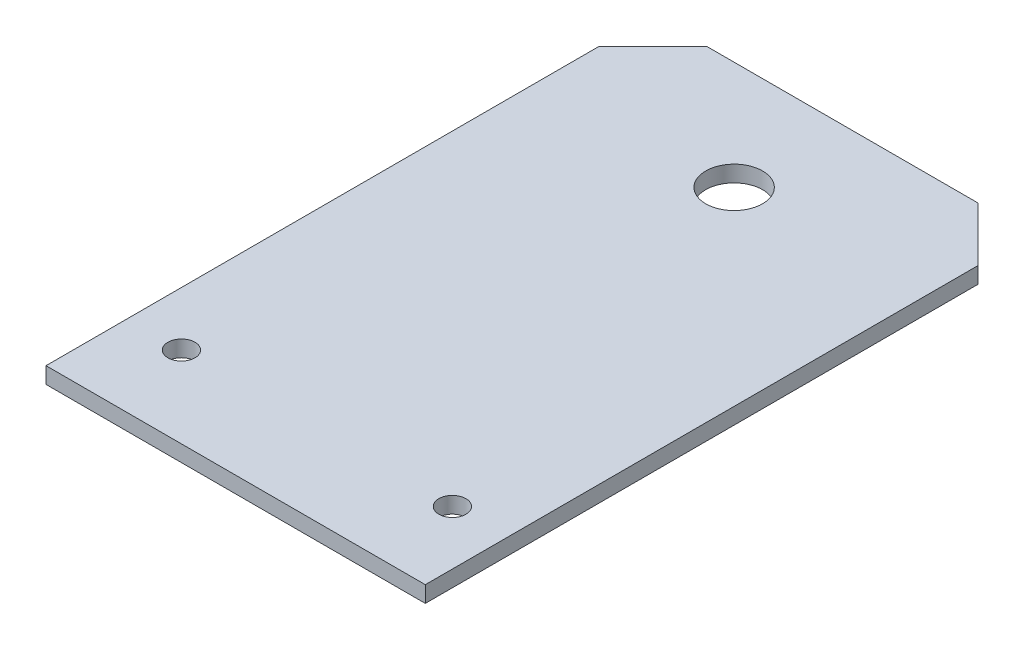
SolidWorks part; units mm, degrees
ref_plane "Front Plane" through (0, 0, 0) normal (0, 0, 1) x (1, 0, 0)
ref_plane "Top Plane" through (0, 0, 0) normal (0, 1, 0) x (1, 0, 0)
ref_plane "Right Plane" through (0, 0, 0) normal (1, 0, 0) x (0, 0, -1)
sketch "Sketch1" plane through (0, 0, 0) normal (0, 1, 0) x (1, 0, 0)
  line L0 (35, 112) -> (35, 0) construction
  line L1 (0, 0) -> (70, 0)
  line L2 (0, 0) -> (0, 102)
  line L3 (10, 112) -> (60, 112)
  line L4 (70, 0) -> (70, 102)
  line L5 (0, 102) -> (10, 112)
  line L6 (60, 112) -> (70, 102)
  circle A0 centre (35, 92) radius 5.25
  circle A1 centre (10, 15) radius 2.5
  circle A2 centre (60, 15) radius 2.5
  point P1 (70, 112)
  point P2 (0, 112)
  dimension "D3" = 10.5
  dimension "D4" = 5
  dimension "D1" = 70
  dimension "D2" = 112
  dimension "D5" = 15
  dimension "D6" = 77
  dimension "D7" = 25
  dimension "D8" = 25
  dimension "D11" = 10
  dimension "D12" = 10
extrude "Extrude1" add sketch "Sketch1" along normal blind 3
